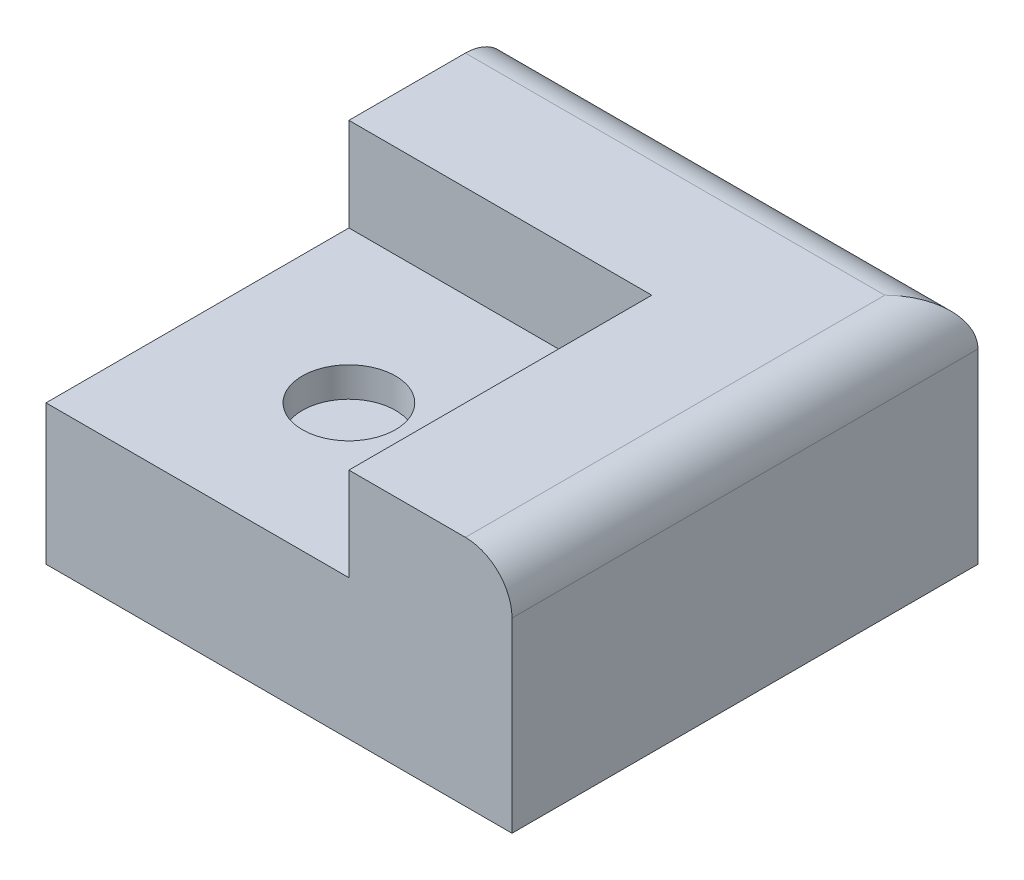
SolidWorks part; units mm, degrees
ref_plane "Front" through (0, 0, 0) normal (0, 0, 1) x (1, 0, 0)
ref_plane "Top" through (0, 0, 0) normal (0, 1, 0) x (1, 0, 0)
ref_plane "Right" through (0, 0, 0) normal (1, 0, 0) x (0, 0, -1)
sketch "Sketch1" plane through (0, 0, 0) normal (0, 1, 0) x (1, 0, 0)
  line L0 (-63.5, 63.5) -> (63.5, -63.5) construction
  line L1 (-63.5, 63.5) -> (63.5, 63.5)
  line L2 (-63.5, 63.5) -> (-63.5, -63.5)
  line L3 (-63.5, -63.5) -> (63.5, -63.5)
  line L4 (63.5, 63.5) -> (63.5, -63.5)
  dimension "D1" = 127
  dimension "D2" = 127
extrude "Extrude1" add sketch "Sketch1" along normal blind 63.5
sketch "Sketch3" plane through (0, 63.5, 0) normal (0, 1, 0) x (-1, 0, 0)
  line L1 (63.5, 63.5) -> (-19.05, 63.5)
  line L2 (63.5, 63.5) -> (63.5, -19.05)
  line L3 (63.5, -19.05) -> (-19.05, -19.05)
  line L4 (-19.05, 63.5) -> (-19.05, -19.05)
  dimension "D1" = 82.55
  dimension "D2" = 82.55
extrude "Inset Cut" cut sketch "Sketch3" against normal blind 25.4
fillet "Fillet1" radius 12.7 2 edges at (63.5, 63.5, 0) (0, 63.5, -63.5)
sketch "Sketch4" plane through (0, 38.1, 0) normal (0, 1, 0) x (-1, 0, 0)
  line L0 (63.5, -19.05) -> (-19.05, 63.5) construction
  circle A0 centre (22.225, 22.225) radius 12.7
  dimension "D1" = 25.4
extrude "Hole" cut sketch "Sketch4" against normal blind 8.128
